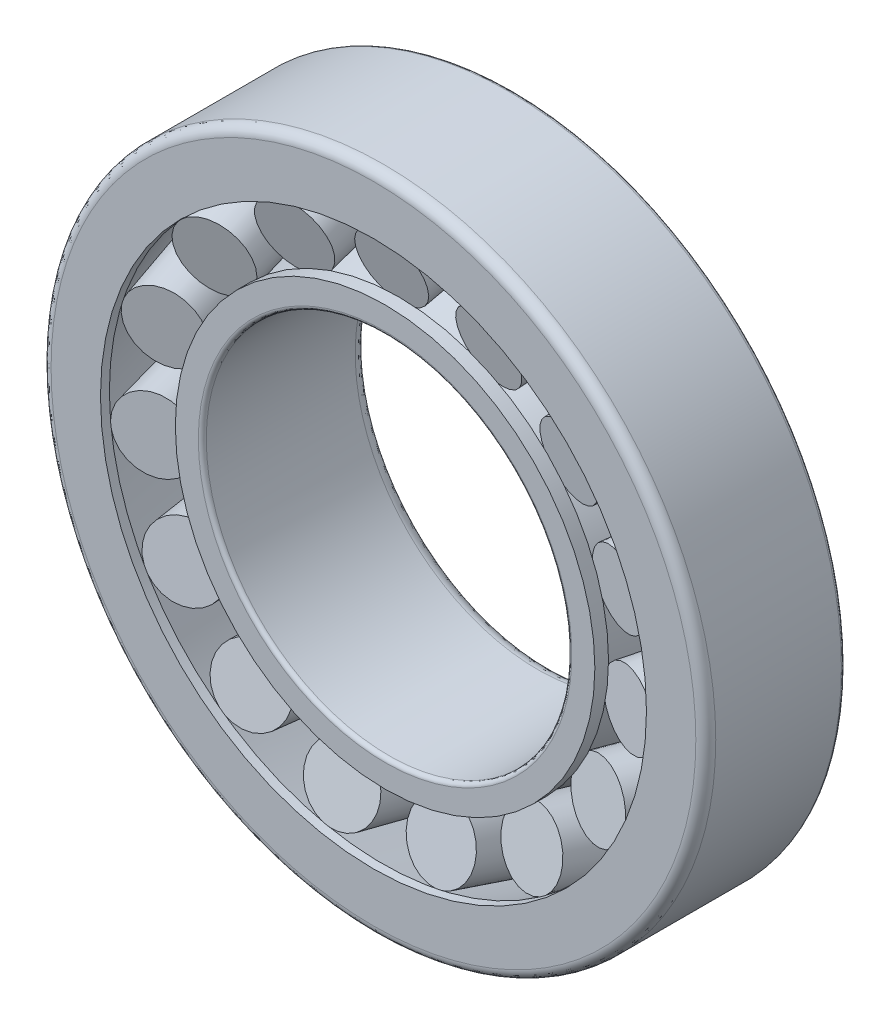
SolidWorks part; units mm, degrees
ref_plane "Front Plane" through (0, 0, 0) normal (0, 0, 1) x (1, 0, 0)
ref_plane "Top Plane" through (0, 0, 0) normal (0, 1, 0) x (1, 0, 0)
ref_plane "Right Plane" through (0, 0, 0) normal (1, 0, 0) x (0, 0, -1)
sketch "BaseSke" plane through (0, 0, 0) normal (1, 0, 0) x (0, 0, -1)
  line L0 (-47.2296, 0) -> (24.6132, 0) construction
  line L2 (0, 129.5214) -> (0, -86.3012) construction
  line L3 (6.7886, 44.1906) -> (-33.5386, 33.3094) construction
  line L4 (-26.75, 50) -> (-5.75, 50) construction
  line L5 (-25, 27.5) -> (0, 27.5) construction
  line L6 (-13.375, 38.75) -> (-20.4266, 64.8845) construction
  line L7 (-25.4125, 41.0943) -> (-7.0875, 46.5572)
  line L8 (-7.0875, 46.5572) -> (-5.5506, 40.8612)
  line L9 (-5.5506, 40.8612) -> (-24.006, 35.8815)
  line L10 (-24.006, 35.8815) -> (-25.4125, 41.0943)
  line L11 (-26.75, 50) -> (-26.75, 41.075) construction
  line L12 (-25.4073, 41.075) -> (-5.75, 46.9351) construction
  line L13 (-5.75, 50) -> (-5.75, 46.9351) construction
  line L14 (-25.4073, 41.075) -> (-26.75, 41.075) construction
  line L15 (-22.5995, 30.6688) -> (-4.0137, 35.1651) construction
  line L16 (-25, 27.5) -> (-25, 31.5604) construction
  line L17 (-25, 31.5604) -> (-22.9436, 31.5604) construction
  line L18 (0, 36.0568) -> (0, 27.5) construction
  line L19 (-22.9436, 31.5604) -> (-22.7097, 30.6935) construction
  line L20 (-22.7097, 30.6935) -> (-3.9295, 35.237) construction
  line L21 (-3.9295, 35.237) -> (-4.1507, 36.0568) construction
  line L22 (-4.1507, 36.0568) -> (0, 36.0568) construction
revolve "Roller" add sketch "BaseSke" angle 360 about L3
sketch "OuterRaceSke" plane through (0, 0, 0) normal (1, 0, 0) x (0, 0, -1)
  line L0 (-25.4073, 41.075) -> (-26.75, 41.075) construction
  line L1 (-25.4073, 41.075) -> (-5.75, 46.9351) construction
  line L2 (-5.75, 50) -> (-5.75, 46.9351) construction
  line L3 (-26.75, 50) -> (-5.75, 50) construction
  line L4 (-26.75, 50) -> (-26.75, 41.075) construction
  line L5 (-25.4073, 41.075) -> (-26.75, 41.075)
  line L6 (-25.4073, 41.075) -> (-5.75, 46.9351)
  line L7 (-5.75, 50) -> (-5.75, 46.9351)
  line L8 (-26.75, 50) -> (-5.75, 50)
  line L9 (-26.75, 50) -> (-26.75, 41.075)
  line L10 (-60.3939, 0) -> (35.9926, 0) construction
revolve "OuterRace" add sketch "OuterRaceSke" angle 360 about L10
sketch "InnerRaceSke" plane through (0, 0, 0) normal (1, 0, 0) x (0, 0, -1)
  line L0 (-25, 27.5) -> (0, 27.5) construction
  line L1 (-25, 27.5) -> (-25, 31.5604) construction
  line L2 (-25, 31.5604) -> (-22.9436, 31.5604) construction
  line L3 (-22.9436, 31.5604) -> (-22.7097, 30.6935) construction
  line L4 (-22.7097, 30.6935) -> (-3.9295, 35.237) construction
  line L5 (-3.9295, 35.237) -> (-4.1507, 36.0568) construction
  line L6 (-4.1507, 36.0568) -> (0, 36.0568) construction
  line L7 (0, 36.0568) -> (0, 27.5) construction
  line L8 (-25, 27.5) -> (0, 27.5)
  line L9 (-25, 27.5) -> (-25, 31.5604)
  line L10 (-25, 31.5604) -> (-22.9436, 31.5604)
  line L11 (-22.9436, 31.5604) -> (-22.7097, 30.6935)
  line L12 (-22.7097, 30.6935) -> (-3.9295, 35.237)
  line L13 (-3.9295, 35.237) -> (-4.1507, 36.0568)
  line L14 (-4.1507, 36.0568) -> (0, 36.0568)
  line L15 (0, 36.0568) -> (0, 27.5)
  line L16 (-58.1022, 0) -> (39.538, 0) construction
revolve "InnerRace" add sketch "InnerRaceSke" angle 360 about L16
fillet "Fillet1" radius 0.6 2 edges at (50, 0, 5.75) (27.5, 0, 25)
fillet "InnerFillet" radius 2 1 edges at (27.5, 0, 0)
fillet "OuterFillet" radius 1.5 1 edges at (50, 0, 26.75)
pattern_circular "CirPatternBall" count 15 over 360 about axis through (0, 0, 0) along (0, 0, 1) of "Roller"
sketch "Sketch4" plane through (0, 0, 0) normal (1, 0, 0) x (0, 0, -1)
  line L0 (-25.4125, 41.0943) -> (-7.0875, 46.5572)
  line L1 (-7.0875, 46.5572) -> (-4.0137, 35.1651)
  line L2 (-4.0137, 35.1651) -> (-22.5995, 30.6688)
  line L3 (-22.5995, 30.6688) -> (-25.4125, 41.0943)
  line L4 (-40.3293, 0) -> (19.5574, 0) construction
revolve "Simplified" [suppressed] add sketch "Sketch4" angle 360 about L4
equation "\"D2@BaseSke\" = \"Bearing_Thickness@BaseSke\"/2"
equation "\"D3@BaseSke\" =  ( \"Bearing_Outside_Diameter@BaseSke\" + \"Bearing_Inside_Diameter@BaseSke\" )  / 2"
equation "\"Roller_diameter@BaseSke\" = \"D3@BaseSke\"*1.06"
equation "\"D4@BaseSke\" = \"Bearing_Thickness@BaseSke\"/20"
equation "\"D5@BaseSke\" = \"Bearing_Thickness@BaseSke\" / 20"
equation "\"D8@BaseSke\" = \"Bearing_Thickness@BaseSke\"/30"
equation "\"D11@BaseSke\" = \"D8@BaseSke\""
equation "\"D1@CirPatternBall\" = int(  \"D3@BaseSke\" *  pi  /  ( \"Bearing_Outside_Diameter@BaseSke\" - \"Bearing_Inside_Diameter@BaseSke\" )  * 2.8 ) "
